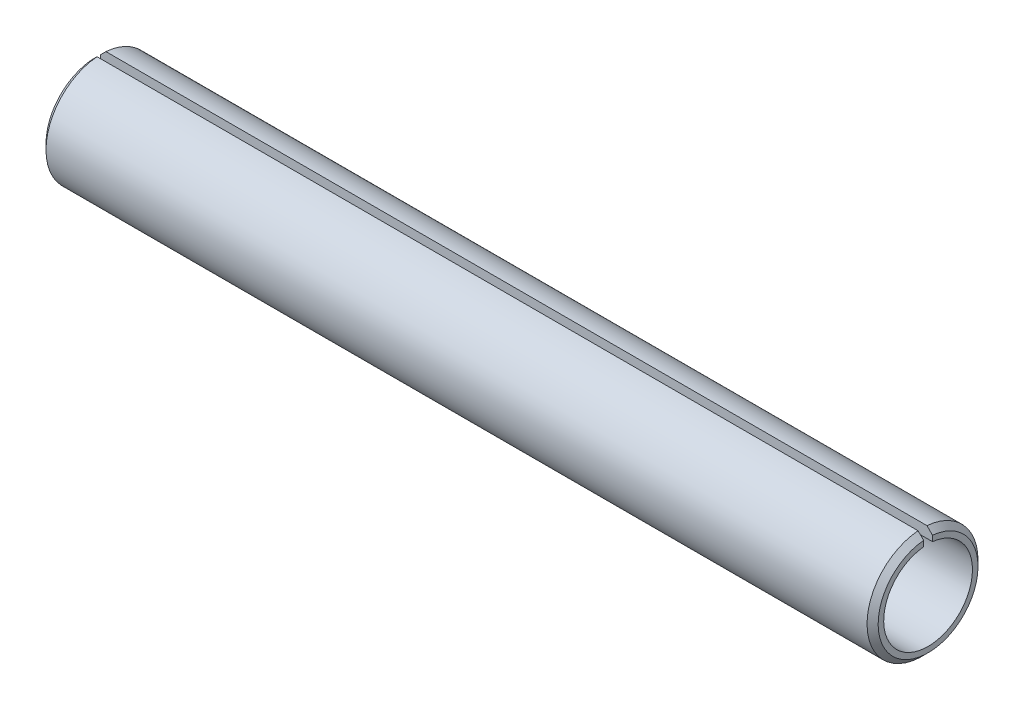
SolidWorks part; units mm, degrees
ref_plane "Plan1" through (0, 0, 0) normal (0, 0, 1) x (1, 0, 0)
ref_plane "Plan2" through (0, 0, 0) normal (0, 1, 0) x (1, 0, 0)
ref_plane "Plan3" through (0, 0, 0) normal (1, 0, 0) x (0, 0, -1)
sketch "Esquisse1" plane through (0, 0, 0) normal (0, 0, 1) x (1, 0, 0)
  line L0 (0, 0.8) -> (0, 0.9)
  line L1 (0, 0.8) -> (15, 0.8)
  line L2 (15, 0.8) -> (15, 0.9)
  line L3 (15, 0.9) -> (14.9, 1)
  line L4 (14.9, 1) -> (0.1, 1)
  line L5 (0.1, 1) -> (0, 0.9)
  line L6 (0, 0) -> (15, 0) construction
  dimension "D1" = 15
  dimension "D2" = 1
  dimension "D3" = 0.2
  dimension "D4" = 45
  dimension "D5" = 45
  dimension "D6" = 0.1
revolve "Base-Révolution" add sketch "Esquisse1" angle 360 about L6
sketch "Esquisse2" plane through (0, 0, 0) normal (1, 0, 0) x (0, 0, -1)
  line L0 (0, 0) -> (0, 1) construction
  line L1 (0.08, 0.9968) -> (0.08, 0.796)
  line L2 (-0.08, 0.9968) -> (-0.08, 0.796)
  circle A0 centre (0, 0) radius 1 construction
  circle A1 centre (0, 0) radius 0.8 construction
  arc A2 (0.08, 0.796) -> (-0.08, 0.796) centre (0, 0) ccw
  arc A3 (0.08, 0.9968) -> (-0.08, 0.9968) centre (0, 0) ccw
  dimension "D1" = 0.08
extrude "Enlèv. mat.-Extru.2" cut sketch "Esquisse2" along normal through all
equation "\"D6@Esquisse1\"=\"D2@Esquisse1\"/10"
equation "\"D1@Esquisse2\"=\"D3@Esquisse1\"/2.5"
